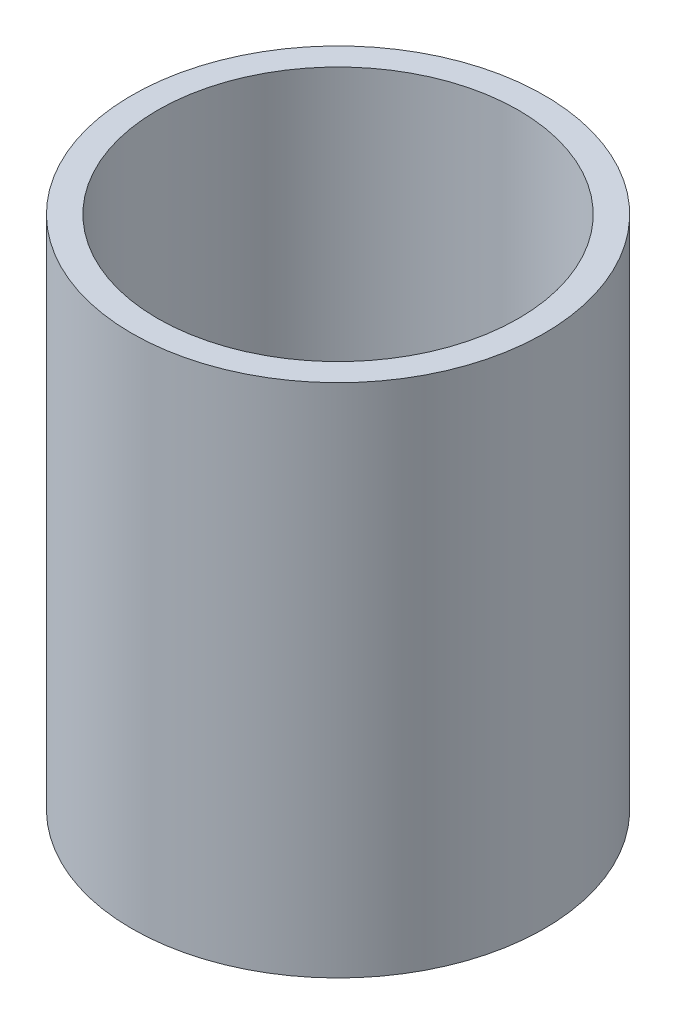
SolidWorks part; units mm, degrees
ref_plane "Front Plane" through (0, 0, 0) normal (0, 0, 1) x (1, 0, 0)
ref_plane "Top Plane" through (0, 0, 0) normal (0, 1, 0) x (1, 0, 0)
ref_plane "Right Plane" through (0, 0, 0) normal (1, 0, 0) x (0, 0, -1)
sketch "Sketch1" plane through (0, 0, 0) normal (0, 1, 0) x (1, 0, 0)
  circle A0 centre (0, 0) radius 12.7
extrude "Extrude1" add sketch "Sketch1" along normal blind 31.75
sketch "Sketch2" plane through (0, 31.75, 0) normal (0, 1, 0) x (1, 0, 0)
  circle A0 centre (0, 0) radius 11.1125
extrude "Extrude2" cut sketch "Sketch2" against normal through all
